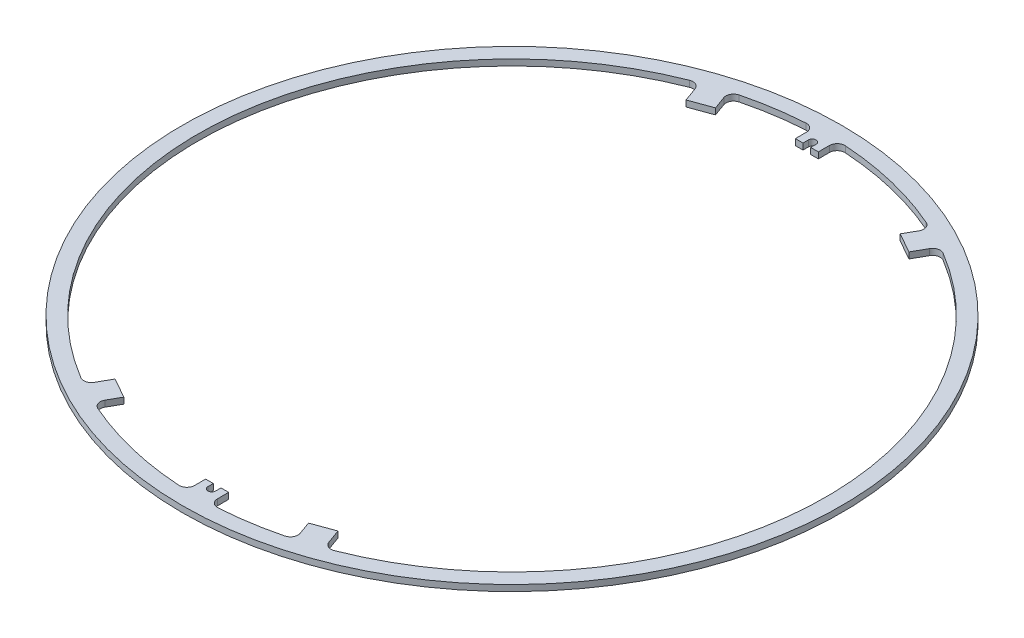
SolidWorks part; units mm, degrees
ref_plane "前视基准面" through (0, 0, 0) normal (0, 0, 1) x (1, 0, 0)
ref_plane "上视基准面" through (0, 0, 0) normal (0, 1, 0) x (1, 0, 0)
ref_plane "右视基准面" through (0, 0, 0) normal (1, 0, 0) x (0, 0, -1)
sketch "草图1" plane through (0, 0, 0) normal (0, 1, 0) x (1, 0, 0)
  circle A0 centre (0, 0) radius 43
  circle A1 centre (0, 0) radius 41
  circle A2 centre (0, 0) radius 35 construction
  dimension "D1" = 86
  dimension "D2" = 2
  dimension "D3" = 70
extrude "凸台-拉伸1" add sketch "草图1" along normal blind 0.8
sketch "草图2" plane through (0, 0.8, 0) normal (0, 1, 0) x (1, 0, 0)
  line L0 (0, 0) -> (0, 47.3857) construction
  line L1 (-1.5, 40.9726) -> (-1.5, 38.4726)
  line L2 (-1.5, 38.4726) -> (1.5, 38.4726)
  line L3 (1.5, 40.9726) -> (1.5, 38.4726)
  line L4 (0, 0) -> (51.4644, 0) construction
  line L5 (1.5, -40.9726) -> (1.5, -38.4726)
  line L6 (-1.5, -40.9726) -> (-1.5, -38.4726)
  line L7 (-1.5, -38.4726) -> (1.5, -38.4726)
  circle A0 centre (0, 0) radius 41 construction
  circle A1 centre (0, 0) radius 41
  point P10 (0, 38.4726)
  dimension "D1" = 2.5
  dimension "D2" = 3
extrude "凸台-拉伸2" add sketch "草图2" against normal up to surface (0.8 mm away) contours L7 L6 L5 M8 | L3 L1 L2 M8
fillet "圆角1" radius 1 2 edges at (1.5, 0.4, -40.9726) (-1.5, 0.4, -40.9726)
fillet "圆角2" radius 1 2 edges at (1.5, 0.4, 40.9726) (-1.5, 0.4, 40.9726)
sketch "草图3" plane through (0, 0, 0) normal (0, -1, 0) x (1, 0, 0)
  line L0 (0, 39.1726) -> (0, 38.4726) construction
  line L1 (1.5, 38.4726) -> (-1.5, 38.4726) construction
  line L2 (-0.5, 39.1726) -> (-0.5, 36.1726)
  line L3 (-0.5, 36.1726) -> (0.5, 36.1726)
  line L4 (0.5, 36.1726) -> (0.5, 39.1726)
  line L5 (0, 0) -> (11.294, 0) construction
  line L6 (0, -39.1726) -> (0, -38.4726) construction
  line L7 (0.5, -36.1726) -> (0.5, -39.1726)
  line L8 (-0.5, -36.1726) -> (0.5, -36.1726)
  line L9 (-0.5, -39.1726) -> (-0.5, -36.1726)
  arc A0 (0.5, 39.1726) -> (-0.5, 39.1726) centre (0, 39.1726) ccw
  arc A1 (0.5, -39.1726) -> (-0.5, -39.1726) centre (0, -39.1726) cw
  dimension "D1" = 1
  dimension "D2" = 3
  dimension "D3" = 0.7
extrude "切除-拉伸1" cut sketch "草图3" against normal through all
sketch "草图4" plane through (0, 0.8, 0) normal (0, 1, 0) x (1, 0, 0)
  line L0 (0, 0) -> (-20.1894, -35.6846) construction
  line L1 (0, 0) -> (0, -48.4381) construction
  line L2 (-20.1894, -35.6846) -> (-18.7121, -33.0735)
  line L3 (-18.7121, -33.0735) -> (-16.101, -34.5508)
  line L4 (-16.101, -34.5508) -> (-17.5242, -37.0662)
  line L5 (20.1894, 35.6846) -> (18.7121, 33.0735)
  line L6 (18.7121, 33.0735) -> (16.101, 34.5508)
  line L7 (16.101, 34.5508) -> (17.5242, 37.0662)
  arc A0 (-2.5625, 40.9198) -> (-2.5625, -40.9198) centre (0, 0) ccw construction
  arc A1 (-20.1894, -35.6846) -> (-17.5242, -37.0662) centre (0, 0) ccw
  arc A2 (20.1894, 35.6846) -> (17.5242, 37.0662) centre (0, 0) ccw
  point P16 (0, 0)
  dimension "D1" = 3
  dimension "D2" = 3
  dimension "D4" = 29.5
  dimension "D3" = 2
extrude "凸台-拉伸3" add sketch "草图4" against normal up to surface (0.8 mm away)
fillet "圆角3" radius 1 4 edges at (20.1894, 0.4, -35.6846) (17.5242, 0.4, -37.0662) (-17.5242, 0.4, 37.0662) (-20.1894, 0.4, 35.6846)
sketch "草图5" plane through (0, 0, 0) normal (0, -1, 0) x (1, 0, 0)
  line L0 (0, 0) -> (-18.7121, 33.0735) construction
  line L1 (0, 0) -> (14.0228, 38.5274) construction
  line L2 (14.0228, 38.5274) -> (12.9968, 35.7083)
  line L3 (12.9968, 35.7083) -> (10.1777, 36.7344)
  line L4 (10.1777, 36.7344) -> (11.1662, 39.4502)
  line L5 (-10.1777, -36.7344) -> (-11.1662, -39.4502)
  line L6 (-12.9968, -35.7083) -> (-10.1777, -36.7344)
  line L7 (-14.0228, -38.5274) -> (-12.9968, -35.7083)
  arc A0 (21.0752, -35.1687) -> (2.5625, 40.9198) centre (0, 0) ccw construction
  arc A1 (14.0228, 38.5274) -> (11.1662, 39.4502) centre (0, 0) ccw
  arc A2 (-14.0228, -38.5274) -> (-11.1662, -39.4502) centre (0, 0) ccw
  point P17 (0, 0)
  dimension "D1" = 49.5
  dimension "D2" = 3
  dimension "D3" = 3
  dimension "D4" = 2
extrude "凸台-拉伸4" add sketch "草图5" against normal up to surface (0.8 mm away)
fillet "圆角4" radius 1 4 edges at (-11.1662, 0.4, -39.4502) (-14.0228, 0.4, -38.5274) (11.1662, 0.4, 39.4502) (14.0228, 0.4, 38.5274)
